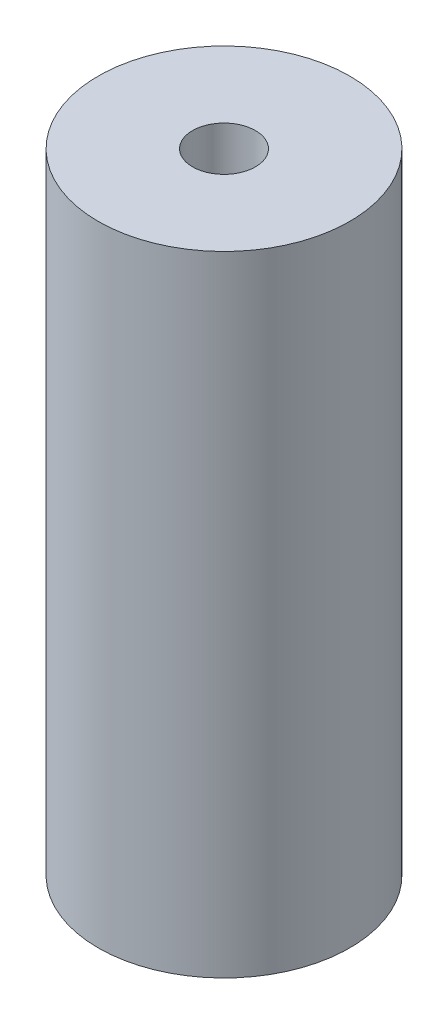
SolidWorks part; units mm, degrees
ref_plane "Front Plane" through (0, 0, 0) normal (0, 0, 1) x (1, 0, 0)
ref_plane "Top Plane" through (0, 0, 0) normal (0, 1, 0) x (1, 0, 0)
ref_plane "Right Plane" through (0, 0, 0) normal (1, 0, 0) x (0, 0, -1)
sketch "Sketch1" plane through (0, 0, 0) normal (0, 1, 0) x (1, 0, 0)
  circle A0 centre (0, 0) radius 12.7
  circle A1 centre (0, 0) radius 3.175
  dimension "D1" = 25.4
  dimension "D2" = 6.35
extrude "Extrude1" add sketch "Sketch1" along normal blind 63.5
sketch "Sketch2" plane through (0, 0, 0) normal (0, -1, 0) x (1, 0, 0)
  line L0 (-7.9375, 0) -> (7.9375, 0) construction
  circle A0 centre (0, 0) radius 7.9375 construction
  dimension "D1" = 15.875
hole_wizard "#33 (0.113) Diameter Hole1" positions "3DSketch2" profile "Sketch4" hole size "#33" standard "Ansi Inch"
sketch3d "3DSketch2"
  point P0 (-7.9375, 0, 0)
  point P3 (7.9375, 0, 0)
sketch "Sketch4" plane through (-7.9375, 0, 0) normal (1, 0, 0) x (0, 0, -1)
  line L0 (0, 0) -> (0, 26.2623)
  line L1 (0, 26.2623) -> (1.4351, 25.4)
  line L2 (1.4351, 25.4) -> (1.4351, 0)
  line L5 (1.4351, 0) -> (0, 0)
  line L10 (0, 26.2623) -> (-1.4351, 25.4) construction
  line L11 (0, -6.35) -> (0, 107.95) construction
  dimension "Hole Dia." = 2.8702
  dimension "Hole Depth" = 25.4
  dimension "Drill Angle" = 118
